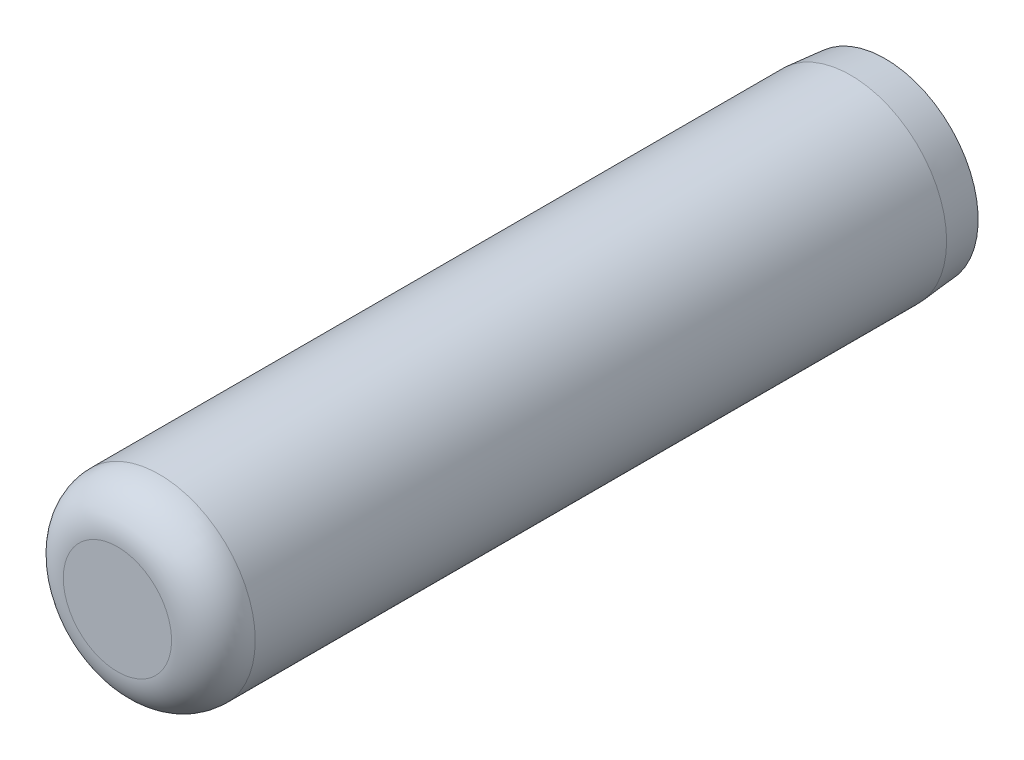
SolidWorks part; units mm, degrees
ref_plane "Front" through (0, 0, 0) normal (0, 0, 1) x (1, 0, 0)
ref_plane "Top" through (0, 0, 0) normal (0, 1, 0) x (1, 0, 0)
ref_plane "Right" through (0, 0, 0) normal (1, 0, 0) x (0, 0, -1)
sketch "Logo3_Revol_Axis" plane through (0, 0, 0) normal (0, 1, 0) x (1, 0, 0)
  line L0 (0, -30.1653) -> (0, 30.1653) construction
sketch "Logo3_bib1" plane through (0, 0, 0) normal (0, -1, 0) x (-1, 0, 0)
  line L0 (0, 25.4) -> (0, -25.4)
  line L1 (6.35, 23.6985) -> (6.35, -23.6985) construction
  line L2 (6.35, -22.6314) -> (6.35, 23.114)
  line L3 (0, 25.4) -> (6.15, 25.4)
  line L4 (6.35, 23.114) -> (6.15, 25.4)
  line L5 (0, -25.4) -> (3.5814, -25.4)
  line L10 (0, 47.5372) -> (0, -34.1764) construction
  arc A0 (6.35, 23.6985) -> (0, 25.4) centre (0, 12.7) ccw construction
  arc A1 (0, -25.4) -> (6.35, -23.6985) centre (0, -12.7) ccw construction
  arc A2 (3.5814, -25.4) -> (6.35, -22.6314) centre (3.5814, -22.6314) ccw
revolve "Revolve1" add sketch "Logo3_bib1" angle 360 about L10
equation "\"ray2@Logo3_bib1\" = \"logo3_d1@Logo3_bib1\""
equation "\"Ray1@Logo3_bib1\" = \"logo3_d1@Logo3_bib1\""
equation "\"dia1@Logo3_bib1\" = \"logo3_d1@Logo3_bib1\"/2"
